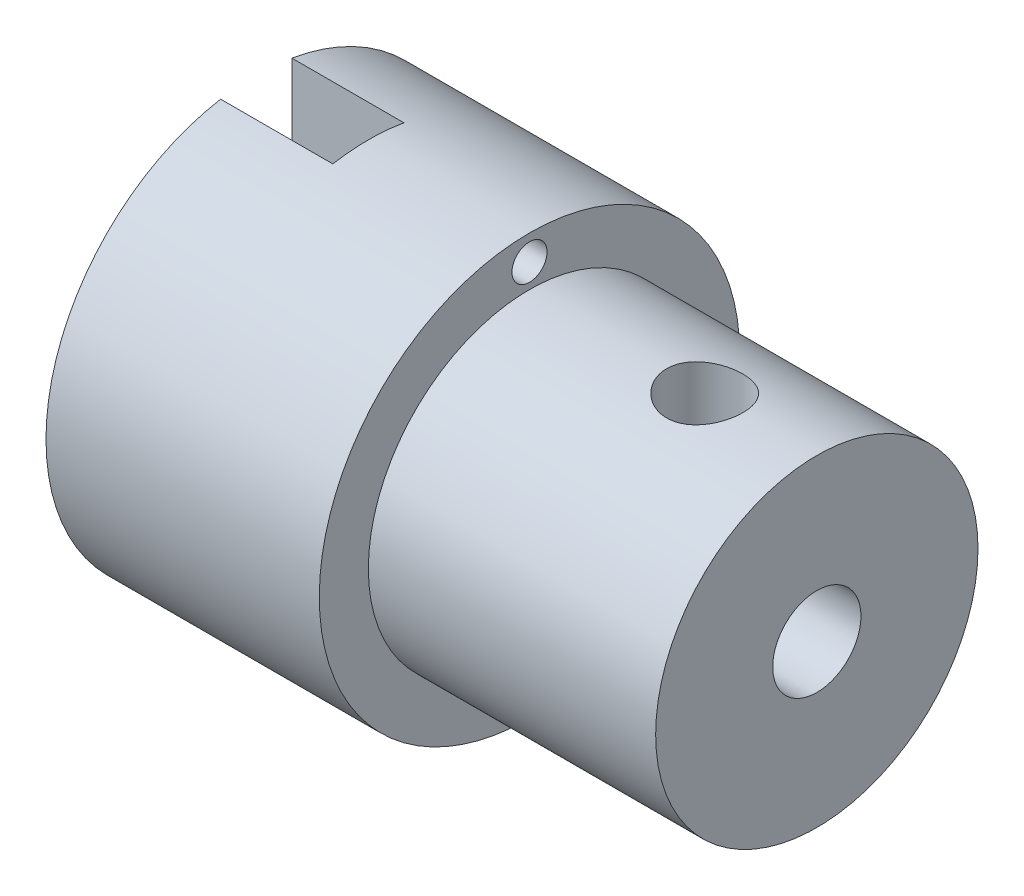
SolidWorks part; units mm, degrees
ref_plane "Front Plane" through (0, 0, 0) normal (0, 0, 1) x (1, 0, 0)
ref_plane "Top Plane" through (0, 0, 0) normal (0, 1, 0) x (1, 0, 0)
ref_plane "Right Plane" through (0, 0, 0) normal (1, 0, 0) x (0, 0, -1)
sketch "Sketch1" plane through (0, 0, 0) normal (1, 0, 0) x (0, 0, -1)
  circle A0 centre (0, 0) radius 1.5875
  circle A1 centre (0, 0) radius 9.525
  dimension "D1" = 3.175
  dimension "D2" = 19.05
extrude "Extrude1" add sketch "Sketch1" along normal blind 25.4
sketch "Sketch5" plane through (25.4, 0, 0) normal (1, 0, 0) x (0, 0, -1)
  circle A0 centre (0, 0) radius 7.3025
  circle A1 centre (0, 0) radius 9.652
  dimension "D1" = 14.605
  dimension "D2" = 19.304
extrude "Cut-Extrude2" cut sketch "Sketch5" against normal offset from surface (13.0175 mm away) 12.3825
sketch "Sketch6" plane through (0, 0, 0) normal (0, 1, 0) x (1, 0, 0)
  line L0 (0, 9.525) -> (0, -9.525) construction
  line L1 (5.08, 1.6129) -> (0, 1.6129)
  line L2 (5.08, -1.6129) -> (0, -1.6129)
  line L3 (0, 1.6129) -> (0, -1.6129)
  line L4 (5.08, 1.6129) -> (5.08, -1.6129)
  point P0 (5.08, 0)
  dimension "D1" = 5.08
  dimension "D2" = 3.2258
extrude "Cut-Extrude3" cut sketch "Sketch6" against normal mid plane 20.32
sketch "Sketch8" plane through (12.3825, 0, 0) normal (1, 0, 0) x (0, 0, -1)
  circle A0 centre (0, 8.382) radius 0.7937
  dimension "D1" = 1.5875
  dimension "D2" = 8.382
extrude "Cut-Extrude4" cut sketch "Sketch8" against normal blind 6.35
hole_wizard "5/16 (0.3125) Diameter Hole1" positions "3DSketch1" profile "Sketch9" hole size "5/16" standard "Ansi Inch"
sketch3d "3DSketch1"
  point P0 (0, 0, 0)
sketch "Sketch9" plane through (0, 0, 0) normal (0, 1, 0) x (0, 0, 1)
  line L0 (0, 0) -> (0, 10.4619)
  line L1 (0, 10.4619) -> (3.9687, 8.0772)
  line L2 (3.9687, 8.0772) -> (3.9687, 0)
  line L5 (3.9687, 0) -> (0, 0)
  line L10 (0, 10.4619) -> (-3.9688, 8.0772) construction
  line L11 (0, -6.35) -> (0, 107.95) construction
  dimension "Hole Dia." = 7.9375
  dimension "Hole Depth" = 8.0772
  dimension "Drill Angle" = 118
hole_wizard "#8-32 Tapped Hole1" positions "Sketch11" profile "Sketch10" tap size "#8-32" standard "Ansi Inch"
sketch "Sketch11" plane through (0, 0, 0) normal (0, 1, 0) x (1, 0, 0)
  line L0 (25.4, -7.3025) -> (25.4, 7.3025) construction
  point P1 (20.32, 0)
  dimension "D1" = 5.08
sketch "Sketch10" plane through (20.32, 0, 0) normal (1, 0, 0) x (0, 0, -1)
  line L0 (0, 0) -> (0, 7.3025)
  line L1 (0, 7.3025) -> (1.7272, 7.3025)
  line L2 (1.7272, 7.3025) -> (1.7272, 0)
  line L5 (1.7272, 0) -> (0, 0)
  line L11 (0, -6.35) -> (0, 107.95) construction
  dimension "Thru Tap Drill Dia." = 3.4544
  dimension "Thru Tap Drill Depth" = 7.3025
sketch "Sketch12" plane through (25.4, 0, 0) normal (1, 0, 0) x (0, 0, -1)
  circle A0 centre (0, 0) radius 2.0002
  dimension "D1" = 4.0005
extrude "Extrude2" cut sketch "Sketch12" against normal blind 10.16
